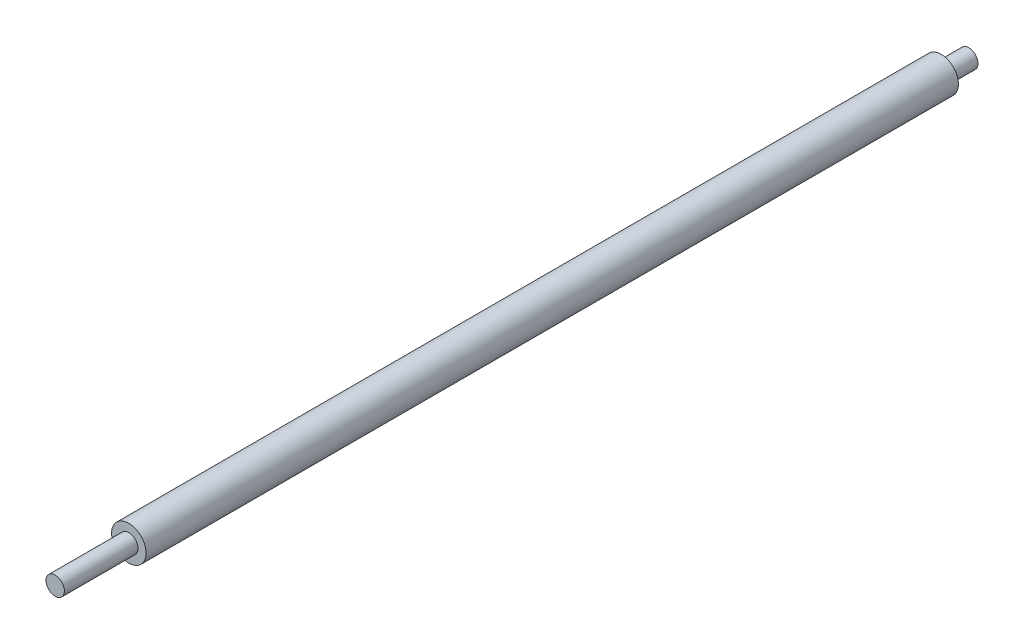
SolidWorks part; units mm, degrees
ref_plane "Alzado" through (0, 0, 0) normal (0, 0, 1) x (1, 0, 0)
ref_plane "Planta" through (0, 0, 0) normal (0, 1, 0) x (1, 0, 0)
ref_plane "Vista lateral" through (0, 0, 0) normal (1, 0, 0) x (0, 0, -1)
sketch "Croquis1" plane through (0, 0, 0) normal (0, 0, 1) x (1, 0, 0)
  circle A0 centre (0, 0) radius 7.5
extrude "Extruir2" add sketch "Croquis1" along normal blind 353
sketch "Croquis3" plane through (0, 0, 353) normal (0, 0, 1) x (1, 0, 0)
  circle A0 centre (0, 0) radius 4
extrude "Extruir3" add sketch "Croquis3" along normal blind 32
sketch "Croquis4" plane through (0, 0, 0) normal (0, 0, -1) x (-1, 0, 0)
  circle A0 centre (0, 0) radius 4
extrude "Extruir4" add sketch "Croquis4" along normal blind 12
